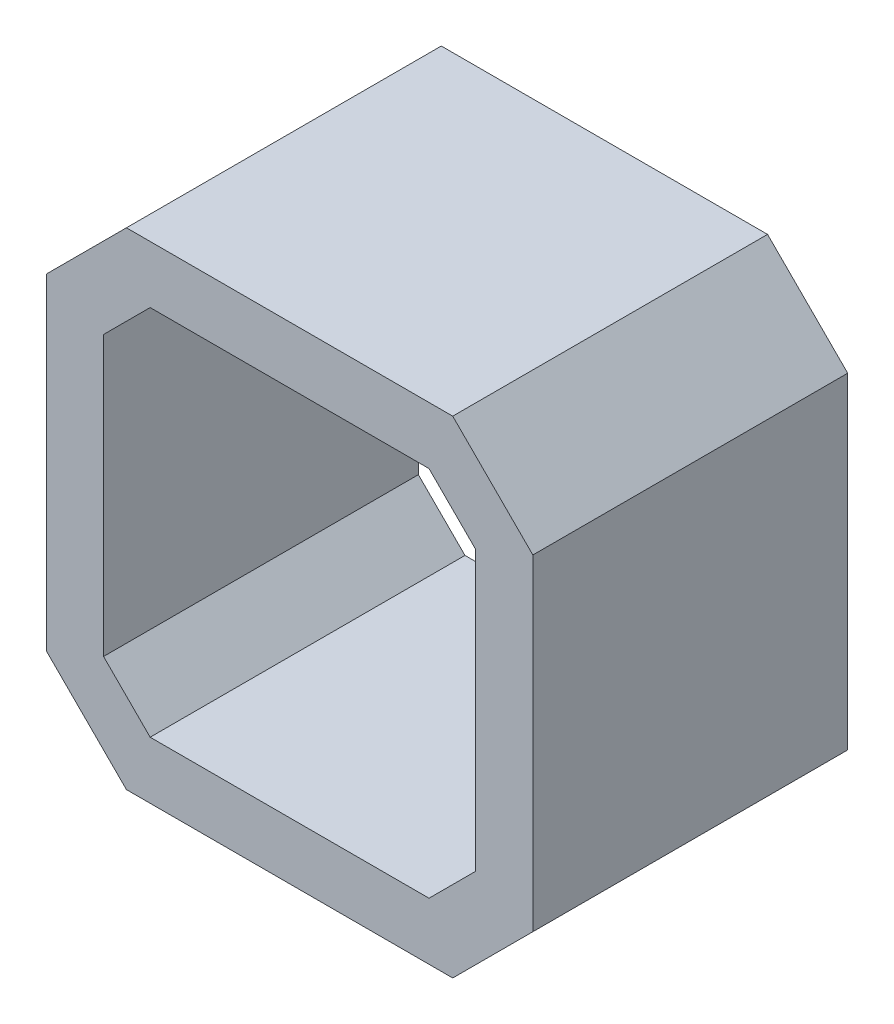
SolidWorks part; units mm, degrees
ref_plane "Front Plane" through (0, 0, 0) normal (0, 0, 1) x (1, 0, 0)
ref_plane "Top Plane" through (0, 0, 0) normal (0, 1, 0) x (1, 0, 0)
ref_plane "Right Plane" through (0, 0, 0) normal (1, 0, 0) x (0, 0, -1)
sketch "Sketch1" plane through (0, 0, 0) normal (0, 0, 1) x (1, 0, 0)
  line L0 (-21.25, 14.25) -> (-14.25, 21.25)
  line L1 (-14.25, -21.25) -> (14.25, -21.25)
  line L2 (-21.25, -14.25) -> (-21.25, 14.25)
  line L3 (-14.25, 21.25) -> (14.25, 21.25)
  line L4 (21.25, -14.25) -> (21.25, 14.25)
  line L5 (-21.25, -21.25) -> (21.25, 21.25) construction
  line L6 (-21.25, 21.25) -> (21.25, -21.25) construction
  line L7 (14.25, 21.25) -> (21.25, 14.25)
  line L8 (14.25, -21.25) -> (21.25, -14.25)
  line L9 (-21.25, -14.25) -> (-14.25, -21.25)
  line L10 (-12.1789, 16.25) -> (12.1789, 16.25)
  line L11 (12.1789, 16.25) -> (16.25, 12.1789)
  line L12 (16.25, -12.1789) -> (16.25, 12.1789)
  line L13 (12.1789, -16.25) -> (16.25, -12.1789)
  line L14 (-12.1789, -16.25) -> (12.1789, -16.25)
  line L15 (-16.25, -12.1789) -> (-12.1789, -16.25)
  line L16 (-16.25, -12.1789) -> (-16.25, 12.1789)
  line L17 (-16.25, 12.1789) -> (-12.1789, 16.25)
  point P0 (0, 0)
  dimension "D1" = 42.5
  dimension "D2" = 42.5
  dimension "D3" = 5
extrude "Boss-Extrude1" add sketch "Sketch1" along normal blind 27.5
